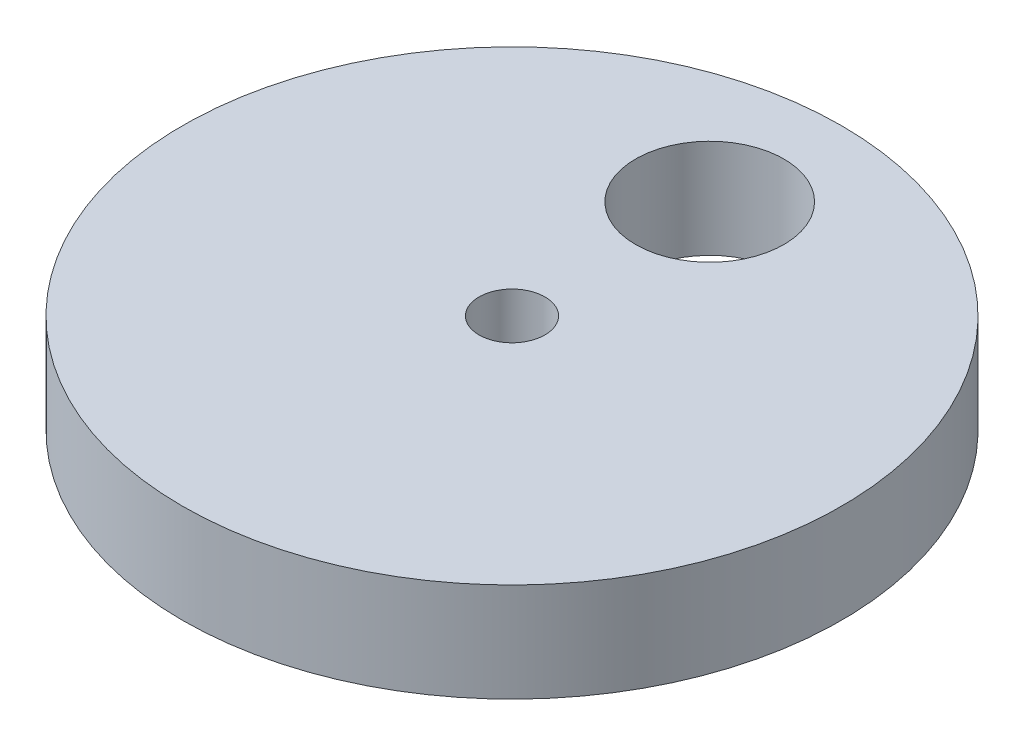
SolidWorks part; units mm, degrees
ref_plane "Front Plane" through (0, 0, 0) normal (0, 0, 1) x (1, 0, 0)
ref_plane "Top Plane" through (0, 0, 0) normal (0, 1, 0) x (1, 0, 0)
ref_plane "Right Plane" through (0, 0, 0) normal (1, 0, 0) x (0, 0, -1)
sketch "Sketch1" plane through (0, 0, 0) normal (0, 1, 0) x (1, 0, 0)
  circle A0 centre (0, 0) radius 10
  circle A1 centre (0, 0) radius 1
  circle A2 centre (0, 6) radius 2.25
  dimension "D1" = 20
  dimension "D2" = 2
  dimension "D3" = 4.5
  dimension "D4" = 6
extrude "Boss-Extrude1" add sketch "Sketch1" along normal blind 3
